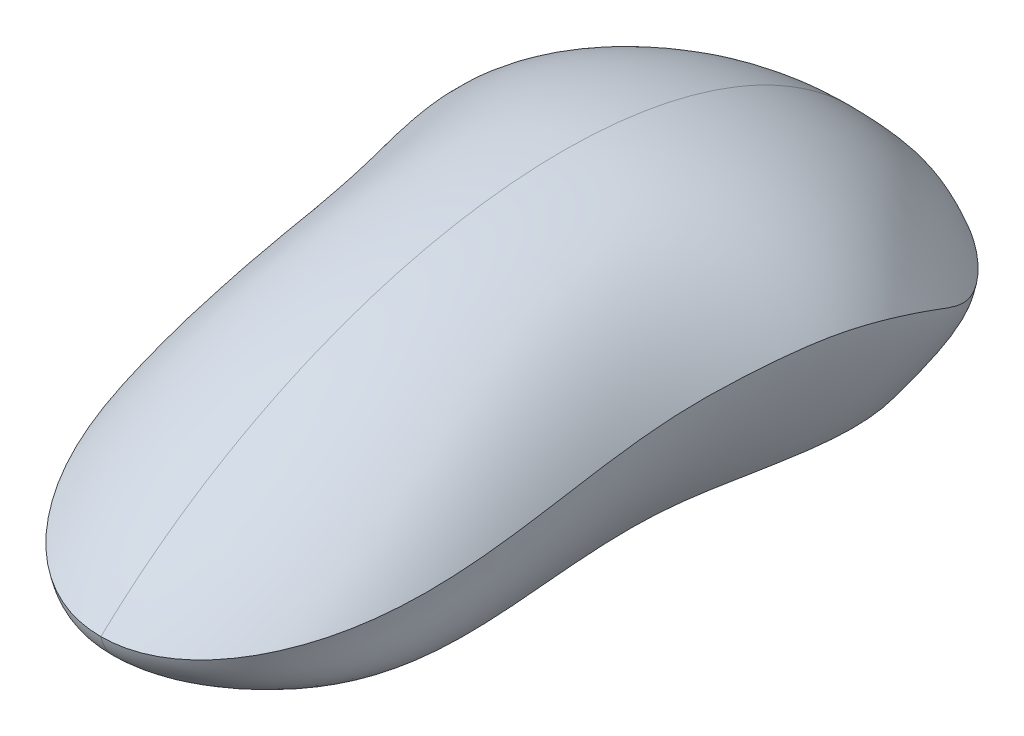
SolidWorks part; units mm, degrees
ref_plane "Front Plane" through (0, 0, 0) normal (0, 0, 1) x (1, 0, 0)
ref_plane "Top Plane" through (0, 0, 0) normal (0, 1, 0) x (1, 0, 0)
ref_plane "Right Plane" through (0, 0, 0) normal (1, 0, 0) x (0, 0, -1)
sketch "Size Reference" plane through (0, 0, 0) normal (0, 1, 0) x (1, 0, 0)
  line L1 (0, 0) -> (27, 0)
  line L2 (0, 0) -> (0, 123) construction
  line L3 (0, 123) -> (27, 123)
  line L4 (27, 0) -> (27, 123)
  dimension "D1" = 123
  dimension "D2" = 54
sketch "Bottom Edge" plane through (0, 0, 0) normal (0, 1, 0) x (1, 0, 0)
  line L0 (0, 123) -> (27, 123) construction
  line L1 (0, 0) -> (27, 0) construction
  line L2 (27, 0) -> (27, 123) construction
  line L4 (27, 93.3111) -> (27, 116.452) construction
  spline S0 degree 3 poles (0, 123) (12.2691, 123) (33.9646, 101.318) (16.4132, 60.3172) (32.5476, 16.6529) (8.4103, 0) (0, 0) knots 0 0 0 0 0.225854 0.474653 0.850222 1 1 1 1
sketch "PL Top Profile" plane through (0, 0, 0) normal (0, 1, 0) x (1, 0, 0)
  line L1 (-4.564, -5.3) -> (14.9352, -5.3) construction
  line L2 (12.7264, 128.6) -> (-2.9487, 128.6) construction
  spline S0 degree 3 poles (0, 128.6) (12.066, 128.6) (43.2672, 103.617) (25.2897, 67.0761) (32.1072, 15.2458) (10.559, -5.3) (0, -5.3) knots 0 0 0 0 0.168813 0.526967 0.825077 1 1 1 1
  dimension "D1" = 5.6
  dimension "D2" = 5.3
sketch "PL Side Profile" plane through (0, 0, 0) normal (1, 0, 0) x (0, 0, -1)
  line L0 (3.2374, 7.8706) -> (0.7101, 7.8706) construction
  spline S0 degree 3 poles (-5.3, 5.6219) (4.2177, 7.7505) (29.2394, 13.3466) (60.5196, 20.2129) (86.0321, 22.1333) (106.0141, 15.5511) (111.8339, 7.8706) (128.6, 7.8706) knots 0 0 0 0 0.22036 0.579318 0.678023 0.775619 1 1 1 1
curve "PL Curve"
sketch "Profile Sketch" plane through (0, 0, 0) normal (1, 0, 0) x (0, 0, -1)
  line L0 (0, 0) -> (28.271, -7.5752) construction
  line L1 (39.4441, 0) -> (-39.4441, 0) construction
  line L2 (123, 0) -> (0, 0) construction
  arc A0 (0, 0) -> (-5.3, 5.6219) centre (1.9034, 7.1036) cw
  arc A1 (123, 0) -> (128.6, 7.8706) centre (118.6653, 9.0117) ccw
  dimension "D2" = 10
  dimension "D1" = 15
ref_plane "Mid Plane" through (0, 0, -65.6195) normal (0, 0, 1) x (1, 0, 0)
sketch "Intermediate Profile" plane through (0, 0, -65.6195) normal (0, 0, 1) x (1, 0, 0)
  line L0 (23.1431, 0) -> (30.4301, 20.1391) construction
  arc A0 (23.1431, 0) -> (30.4301, 20.1391) centre (-15.7575, 25.4634) ccw
  dimension "D1" = 1.25
surface "Surface-Loft1"
sketch "Sketch1" plane through (0, 0, 0) normal (1, 0, 0) x (0, 0, -1)
  line L0 (50.804, -31.7684) -> (21.9756, 24.8105) construction
  line L1 (39.4441, 0) -> (-39.4441, 0) construction
  ellipse E0 centre (50.804, -31.7684) end of major axis (128.6, 7.8706) minor radius 63.5 (-5.3, 5.6219) -> (128.6, 7.8706) cw
  dimension "D1" = 117
  dimension "D2" = 63.5
surface "Surface-Extrude1" sketch "Sketch1" parameters "D1"=12.7
surface "Surface-Fill1"
mirror "Mirror1" about plane through (0, 0, 0) normal (1, 0, 0)
surface "Surface-Plane1"
surface "Surface-Knit1"
sketch "Sketch3" plane through (0, 0, 0) normal (0, 1, 0) x (1, 0, 0)
  line L0 (11.4708, -2) -> (1.723, -7.981) construction
  line L1 (0, 0) -> (0, 52.4557) construction
  line L2 (11.4708, -2) -> (24.3037, 5.5689) construction
  line L4 (1.5, 46.8089) -> (1.5, 63.2)
  line L6 (-1.5, 46.8089) -> (-1.5, 63.2)
  arc A0 (5.899, 2.36) -> (4.7003, 43.7442) centre (-57.3436, 21.2376) ccw
  arc A1 (11.4708, -2) -> (5.899, 2.36) centre (9.5403, 1.2731) cw
  arc A2 (4.7003, 43.7442) -> (1.5, 46.8089) centre (0, 42.0392) ccw
  arc A3 (-11.4708, -2) -> (-5.899, 2.36) centre (-9.5403, 1.2731) ccw
  arc A4 (-5.899, 2.36) -> (-4.7003, 43.7442) centre (57.3436, 21.2376) cw
  arc A5 (1.5, 63.2) -> (-1.5, 63.2) centre (0, 63.2) ccw
  arc A6 (-1.5, 46.8089) -> (-4.7003, 43.7442) centre (0, 42.0392) ccw
  spline S1 degree 3 number of poles 90 (0, 128.6) -> (0, -5.3) construction
  spline S2 degree 3 number of poles 90 (0, 128.6) -> (0, -5.3) construction
  dimension "D1" = 3.8
  dimension "D2" = 66
  dimension "D5" = 5
  dimension "D3" = 70
  dimension "D4" = 179
  dimension "D6" = 3
  dimension "D7" = 2.36
  dimension "D8" = 2
surface "Wheel Mount Split Surface" sketch "Sketch3"
